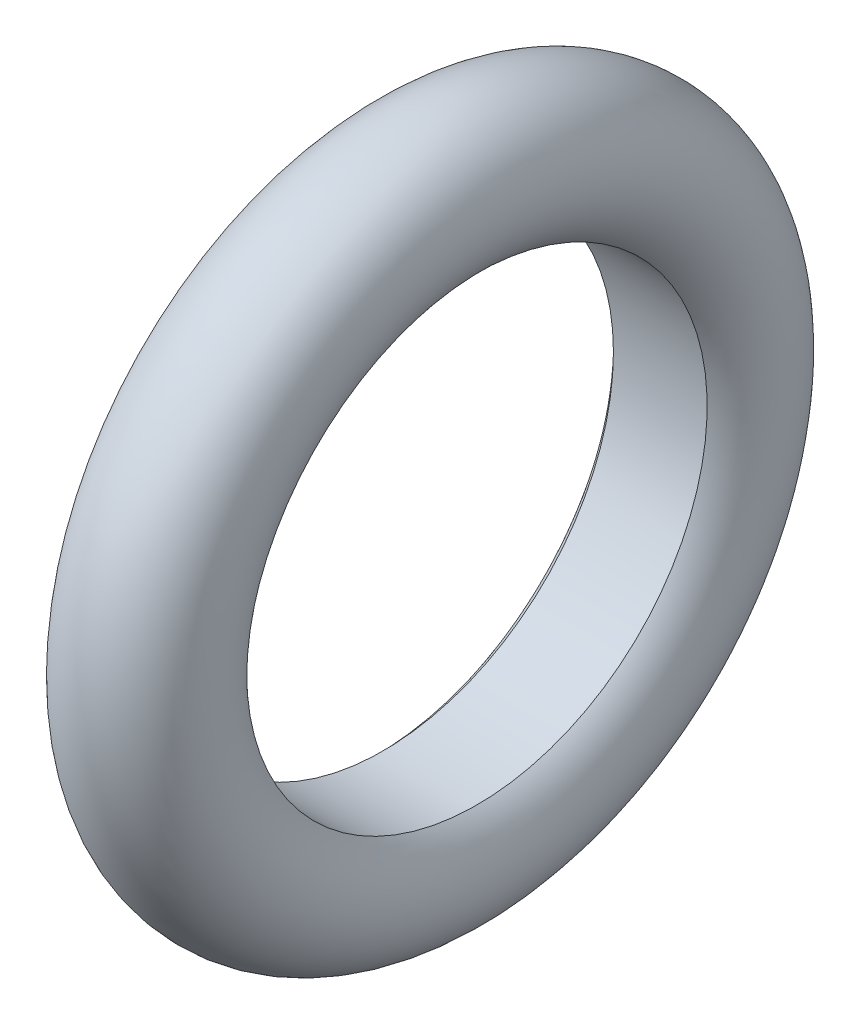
SolidWorks part; units mm, degrees
ref_plane "Plan de face" through (0, 0, 0) normal (0, 0, 1) x (1, 0, 0)
ref_plane "Plan de dessus" through (0, 0, 0) normal (0, 1, 0) x (1, 0, 0)
ref_plane "Plan de droite" through (0, 0, 0) normal (1, 0, 0) x (0, 0, -1)
sketch "Esquisse1" plane through (0, 0, 0) normal (0, 0, 1) x (1, 0, 0)
  line L0 (0, 0) -> (0, 8) construction
  line L1 (0, 0) -> (77.9253, 0) construction
  circle A0 centre (0, 4) radius 1
  dimension "D1" = 2
  dimension "D2" = 4
revolve "Révolution1" add sketch "Esquisse1" angle 360 about L1
sketch "Esquisse2" plane through (0, 0, 0) normal (1, 0, 0) x (0, 0, -1)
  circle A0 centre (0, 0) radius 3.25
  dimension "D1" = 6.5
extrude "Enlèv. mat.-Extru.2" cut sketch "Esquisse2" against normal through all and the other way through all
